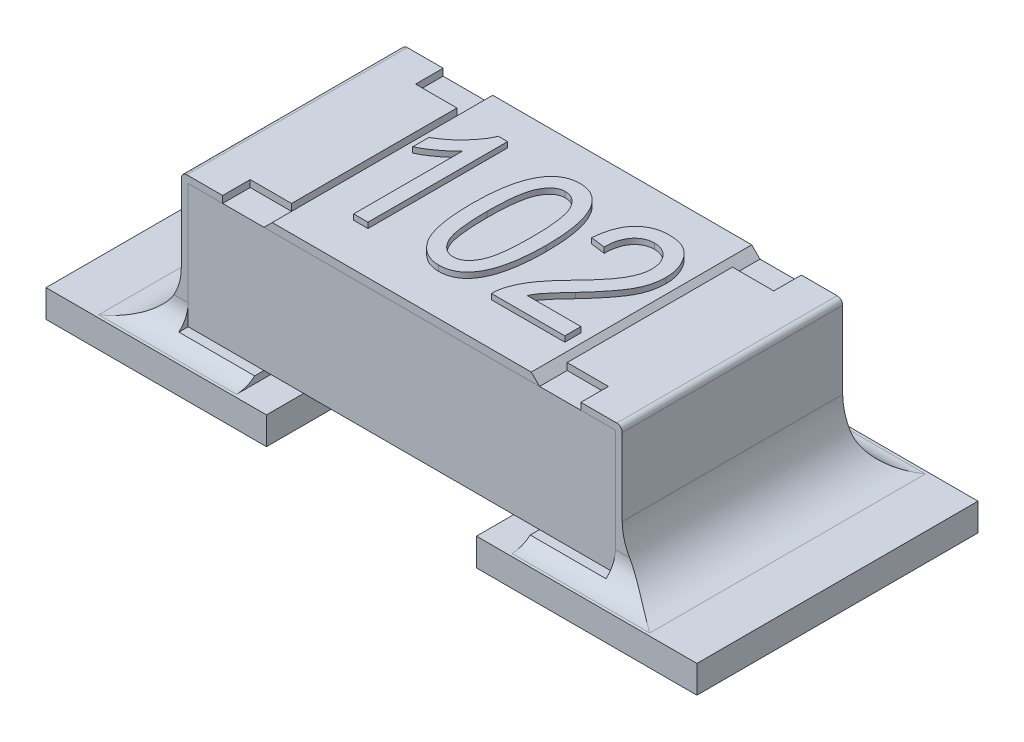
SolidWorks part; units mm, degrees
ref_plane "Front Plane" through (0, 0, 0) normal (0, 0, 1) x (1, 0, 0)
ref_plane "Top Plane" through (0, 0, 0) normal (0, 1, 0) x (1, 0, 0)
ref_plane "Right Plane" through (0, 0, 0) normal (1, 0, 0) x (0, 0, -1)
sketch "Sketch1" plane through (0, 0, 0) normal (1, 0, 0) x (0, 0, -1)
  line L0 (0, 55) -> (0, -55) construction
  line L1 (-0.4, 0.575) -> (0.4, 0.575)
  line L2 (-0.4, 0.575) -> (-0.4, 0.125)
  line L3 (-0.4, 0.125) -> (0.4, 0.125)
  line L4 (0.4, 0.575) -> (0.4, 0.125)
  line L5 (55, 0) -> (-55, 0) construction
  dimension "D1" = 0.8
  dimension "D2" = 0.4
  dimension "D3" = 0.45
  dimension "D4" = 0.125
extrude "Boss-Extrude1" add sketch "Sketch1" along normal mid plane 1.55
sketch "Sketch2" plane through (0, 0, 0) normal (0, 0, 1) x (1, 0, 0)
  line L0 (-0.5, 0.6) -> (-0.78, 0.6)
  line L1 (-0.8, 0.58) -> (-0.8, 0.1)
  line L2 (-0.8, 0.1) -> (-0.5, 0.1)
  line L3 (-0.5, 0.1) -> (-0.5, 0.125)
  line L4 (0.775, 0.125) -> (-0.775, 0.125) construction
  line L5 (-0.5, 0.125) -> (-0.775, 0.125)
  line L6 (-0.775, 0.125) -> (-0.775, 0.575)
  line L7 (-0.775, 0.575) -> (-0.5, 0.575)
  line L8 (0.775, 0.575) -> (-0.775, 0.575) construction
  line L9 (-0.5, 0.575) -> (-0.5, 0.6)
  line L11 (0.5, 0.575) -> (0.5, 0.6)
  line L12 (0.5, 0.6) -> (0.78, 0.6)
  line L13 (0.8, 0.58) -> (0.8, 0.1)
  line L14 (0.8, 0.1) -> (0.5, 0.1)
  line L15 (0.5, 0.1) -> (0.5, 0.125)
  line L16 (0.5, 0.125) -> (0.775, 0.125)
  line L17 (0.775, 0.125) -> (0.775, 0.575)
  line L18 (0.775, 0.575) -> (0.5, 0.575)
  arc A0 (0.78, 0.6) -> (0.8, 0.58) centre (0.78, 0.58) cw
  arc A1 (-0.78, 0.6) -> (-0.8, 0.58) centre (-0.78, 0.58) ccw
  point P28 (-0.8, 0.6)
  dimension "D6" = 0.02
  dimension "D1" = 0.025
  dimension "D2" = 0.025
  dimension "D3" = 0.025
  dimension "D4" = 0.3
  dimension "D5" = 0.3
extrude "Boss-Extrude2" add sketch "Sketch2" along normal mid plane 0.8 separate body
sketch "Sketch3" plane through (0, 0.6, 0) normal (0, 1, 0) x (1, 0, 0)
  line L0 (0.5, -0.4) -> (0.5, 0.4) construction
  line L1 (-0.5, 0.4) -> (-0.65, 0.4)
  line L2 (-0.5, 0.4) -> (-0.5, 0.3)
  line L3 (-0.5, 0.3) -> (-0.65, 0.3)
  line L4 (-0.65, 0.4) -> (-0.65, 0.3)
  line L5 (-0.5, -0.4) -> (-0.65, -0.4)
  line L6 (-0.5, -0.4) -> (-0.5, -0.3)
  line L7 (-0.5, -0.3) -> (-0.65, -0.3)
  line L8 (-0.65, -0.4) -> (-0.65, -0.3)
  line L9 (0.5, -0.4) -> (0.65, -0.4)
  line L10 (0.5, -0.4) -> (0.5, -0.3)
  line L11 (0.5, -0.3) -> (0.65, -0.3)
  line L12 (0.65, -0.4) -> (0.65, -0.3)
  line L13 (0.775, -0.4) -> (-0.775, -0.4) construction
  line L15 (0.5, 0.4) -> (0.65, 0.4)
  line L16 (0.5, 0.4) -> (0.5, 0.3)
  line L17 (0.5, 0.3) -> (0.65, 0.3)
  line L18 (0.65, 0.4) -> (0.65, 0.3)
  dimension "D1" = 0.15
  dimension "D2" = 0.1
extrude "Cut-Extrude1" cut sketch "Sketch3" against normal blind 0.025
sketch "Sketch4" plane through (0, 0, 0) normal (0, 0, 1) x (1, 0, 0)
  line L0 (-0.5, 0.575) -> (0.5, 0.575)
  line L1 (0.5, 0.575) -> (0.47, 0.605)
  line L2 (0.47, 0.605) -> (-0.47, 0.605)
  line L3 (-0.47, 0.605) -> (-0.5, 0.575)
  dimension "D1" = 45
  dimension "D2" = 45
  dimension "D3" = 0.03
extrude "Boss-Extrude3" add sketch "Sketch4" along normal mid plane 0.8 separate body
sketch "Sketch7" plane through (0, 0, 0) normal (0, 1, 0) x (1, 0, 0)
  line L0 (0, -0.2833) -> (0, 0.2833) construction
  line L1 (-0.381, -0.51) -> (-1.181, -0.51)
  line L2 (-0.381, -0.51) -> (-0.381, 0.51)
  line L3 (-0.381, 0.51) -> (-1.181, 0.51)
  line L4 (-1.181, -0.51) -> (-1.181, 0.51)
  line L5 (0.381, -0.51) -> (1.181, -0.51)
  line L6 (0.381, -0.51) -> (0.381, 0.51)
  line L7 (0.381, 0.51) -> (1.181, 0.51)
  line L8 (1.181, -0.51) -> (1.181, 0.51)
  line L9 (-0.2833, 0) -> (0.2833, 0) construction
  dimension "D1" = 0.8
  dimension "D2" = 0.381
  dimension "D3" = 0.381
  dimension "D4" = 1.02
  dimension "D5" = 0.51
extrude "Boss-Extrude5" add sketch "Sketch7" along normal blind 0.1
fillet "Fillet3" radius 0.2 1 edges at (-0.8, 0.1, 0)
fillet "Fillet4" radius 0.2 1 edges at (0.8, 0.1, 0)
fillet "Fillet5" radius 0.1 2 edges at (0.75, 0.1, -0.4) (0.75, 0.1, 0.4)
fillet "Fillet6" radius 0.1 2 edges at (-0.75, 0.1, 0.4) (-0.75, 0.1, -0.4)
sketch "Esquisse2" plane through (0, 0.605, 0) normal (0, 1, 0) x (1, 0, 0)
  text T0 "102" font "Arial Narrow" height 0.5
extrude "Boss.-Extru.1" add sketch "Esquisse2" along normal blind 0.02
